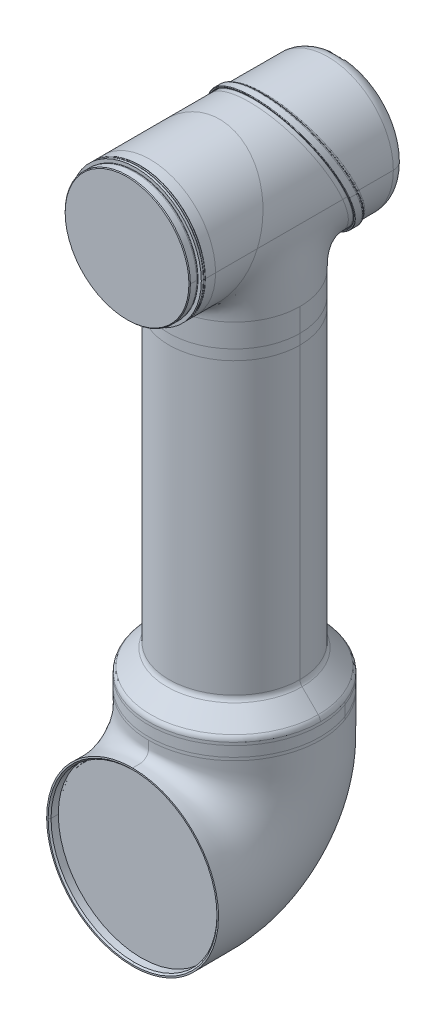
SolidWorks part; units mm, degrees
ref_plane "前视基准面" through (0, 0, 0) normal (0, 0, 1) x (1, 0, 0)
ref_plane "上视基准面" through (0, 0, 0) normal (0, 1, 0) x (1, 0, 0)
ref_plane "右视基准面" through (0, 0, 0) normal (1, 0, 0) x (0, 0, -1)
imported_body "输入1"
chamfer "倒角1" distance 0.5 angle 45
ref_plane "基准面1" through (0, 80.9289, 0) normal (0, 1, 0) x (1, 0, 0)
ref_plane "基准面2" through (0, 78.9989, 0) normal (0, 1, 0) x (1, 0, 0)
ref_plane "基准面3" through (0, 71.9989, 0) normal (0, 1, 0) x (1, 0, 0)
ref_plane "基准面4" through (-0.0002, 511.4999, 0.0002) normal (0, -1, 0) x (-1, 0, 0)
ref_plane "基准面5" through (-0.0002, 495.4999, 0.0002) normal (0, -1, 0) x (-1, 0, 0)
ref_plane "基准面6" through (-0.0002, 488.4999, 0.0002) normal (0, -1, 0) x (-1, 0, 0)
ref_plane "基准面7" through (0, 0, -12) normal (0, 0, 1) x (1, 0, 0)
ref_plane "基准面8" through (0, 0, -5) normal (0, 0, 1) x (1, 0, 0)
ref_plane "基准面9" through (0, 122.3631, -288.2694) normal (0, -0.3907, 0.9205) x (1, 0, 0)
split "分割1" trim tools "基准面2", "基准面3" bodies to split 109 resulting bodies 110 111 112
split "分割2" trim tools "基准面5", "基准面6" bodies to split 111 resulting bodies 113 114 115
split "分割3" trim tools "基准面8", "基准面7", "基准面9" bodies to split 115 resulting bodies 116 117 118 119
ref_plane "基准面10" through (0, 99.0711, 0) normal (0, 1, 0) x (1, 0, 0)
ref_plane "基准面11" through (0, 289.5711, 0) normal (0, 1, 0) x (1, 0, 0)
split "分割4" trim tools "基准面11", "基准面10" bodies to split 114 resulting bodies 120 121
move or copy body "实体-移动/复制1" bodies to move or copy 117 116 120 119 118 113 placed by mates yes
combine bodies "组合1" operation type add bodies to combine 121 124
